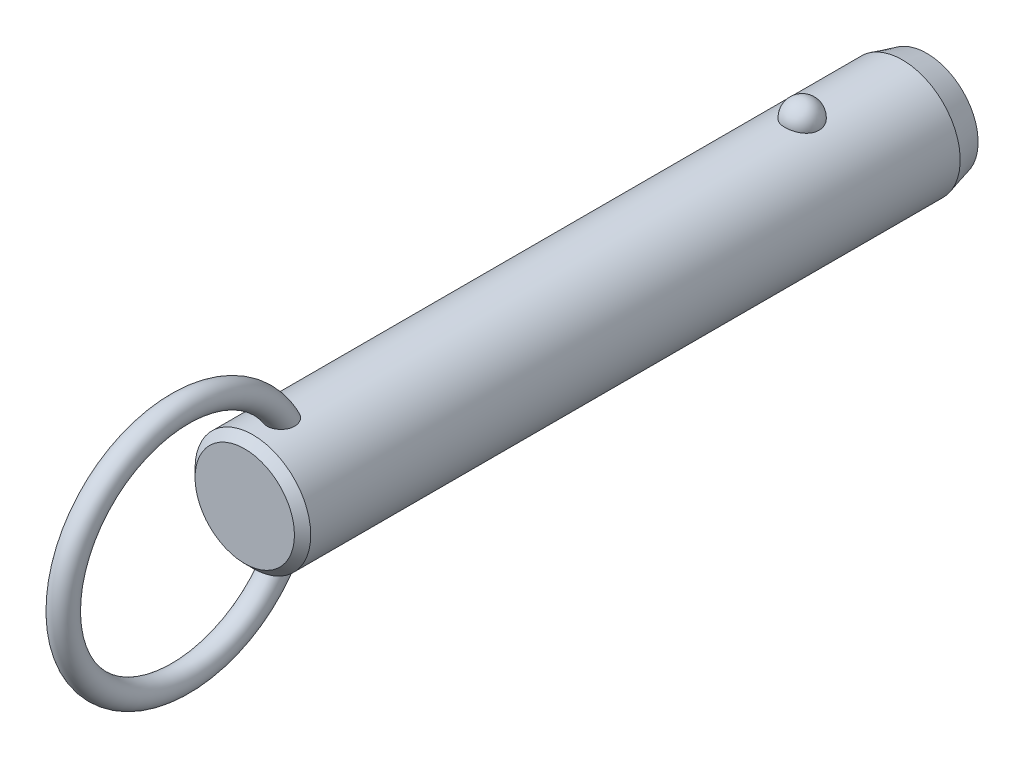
SolidWorks part; units mm, degrees
ref_plane "Front Plane" through (0, 0, 0) normal (0, 0, 1) x (1, 0, 0)
ref_plane "Top Plane" through (0, 0, 0) normal (0, 1, 0) x (1, 0, 0)
ref_plane "Right Plane" through (0, 0, 0) normal (1, 0, 0) x (0, 0, -1)
sketch "Sketch2" plane through (0, 0, 0) normal (0, 0, 1) x (1, 0, 0)
  circle A0 centre (0, 0) radius 7.1
  point P3 (0, 7.1)
  dimension "D1" = 14.2
extrude "Boss-Extrude1" add sketch "Sketch2" along normal blind 58.4
sketch "Sketch3" plane through (0, 0, 0) normal (0, 0, -1) x (-1, 0, 0)
  circle A0 centre (0, 0) radius 7.1
  dimension "D1" = 14.2
extrude "Boss-Extrude2" add sketch "Sketch3" along normal blind 17.4
chamfer "Chamfer1" distance 3 angle 15 1 edges at (-7.1, 0, -17.4)
sketch "Sketch12" plane through (0, 0, 0) normal (1, 0, 0) x (0, 0, -1)
  line L0 (-58.4, 7.1) -> (-58.4, -7.1) construction
  point P0 (-58.4, 0)
sketch "Sketch13" plane through (0, 0, 0) normal (1, 0, 0) x (0, 0, -1)
  circle A0 centre (-74.25, 0) radius 15.85
  point P2 (-58.4, 0)
  dimension "D1" = 31.7
sketch "Sketch14" plane through (0, 0, 0) normal (0, 1, 0) x (1, 0, 0)
  circle A0 centre (0, -59.9) radius 1.5
  point P2 (0, -58.4)
  dimension "D1" = 3
sweep "Sweep1" add profiles "Sketch14" path "Sketch13"
sketch "Sketch15" plane through (0, 0, 58.4) normal (0, 0, 1) x (1, 0, 0)
  circle A0 centre (0, 0) radius 7.1
  dimension "D1" = 14.2
extrude "Boss-Extrude3" add sketch "Sketch15" along normal blind 7.92
chamfer "Chamfer2" distance 1 angle 45 1 edges at (7.1, 0, 66.32)
sketch "Sketch18" plane through (0, 0, 0) normal (1, 0, 0) x (0, 0, -1)
  line L0 (14.4, 7.1) -> (-60.0792, 7.1) construction
  line L1 (2.1, 9.2) -> (2.1, 5)
  line L2 (-60.0792, -7.1) -> (14.4, -7.1) construction
  arc A0 (2.1, 9.2) -> (2.1, 5) centre (2.1, 7.1) ccw
  point P4 (0, 7.1)
  dimension "D1" = 16.3
revolve "Revolve1" add sketch "Sketch18" angle 360 about L1
